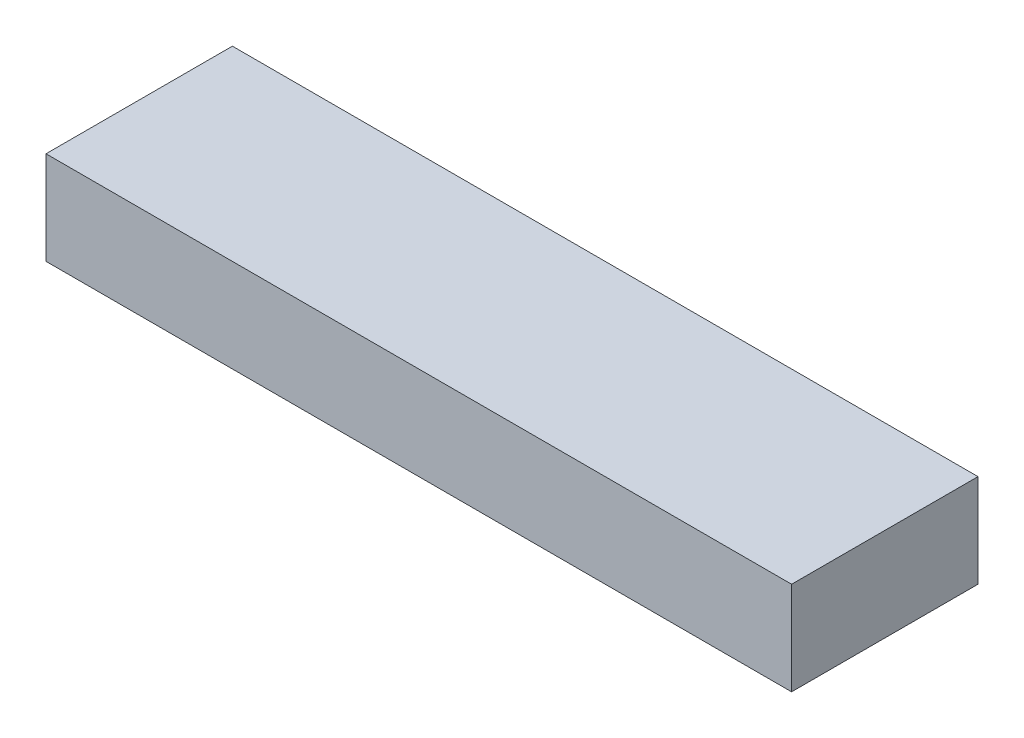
SolidWorks part; units mm, degrees
ref_plane "Plan de face" through (0, 0, 0) normal (0, 0, 1) x (1, 0, 0)
ref_plane "Plan de dessus" through (0, 0, 0) normal (0, 1, 0) x (1, 0, 0)
ref_plane "Plan de droite" through (0, 0, 0) normal (1, 0, 0) x (0, 0, -1)
sketch "Esquisse1" plane through (0, 0, 0) normal (1, 0, 0) x (0, 0, -1)
  line L1 (0, 0) -> (30, 0)
  line L2 (0, 0) -> (0, 15)
  line L3 (0, 15) -> (30, 15)
  line L4 (30, 0) -> (30, 15)
  dimension "D1" = 30
  dimension "D2" = 15
extrude "Boss.-Extru.1" add sketch "Esquisse1" along normal blind 120
